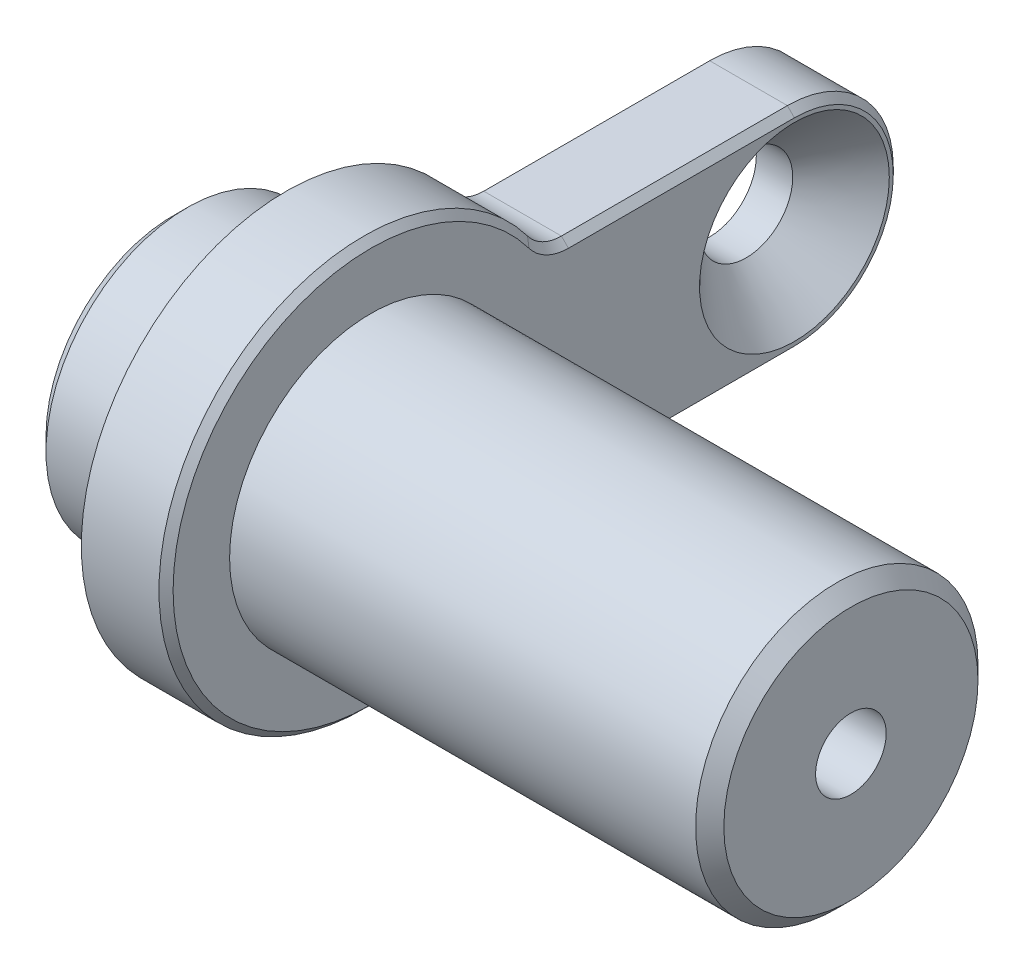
SolidWorks part; units mm, degrees
ref_plane "Front" through (0, 0, 0) normal (0, 0, 1) x (1, 0, 0)
ref_plane "Top" through (0, 0, 0) normal (0, 1, 0) x (1, 0, 0)
ref_plane "Right" through (0, 0, 0) normal (1, 0, 0) x (0, 0, -1)
sketch "Sketch1" plane through (0, 0, 0) normal (1, 0, 0) x (0, -1, 0)
  circle A0 centre (0, 0) radius 10
  dimension "D1" = 20
extrude "Boss-Extrude1" add sketch "Sketch1" along normal blind 40 and the other way blind 8
sketch "Sketch3" plane through (0, 0, 0) normal (1, 0, 0) x (0, 0, -1)
  line L0 (0, 0) -> (30, 0) construction
  line L1 (12.4097, 7.5) -> (30, 7.5)
  line L3 (12.4097, -7.5) -> (30, -7.5)
  line L4 (30, 7.5) -> (30, -7.5) construction
  arc A0 (12.4097, 7.5) -> (12.4097, -7.5) centre (0, 0) ccw
  arc A1 (30, 7.5) -> (30, -7.5) centre (30, 0) cw
  dimension "D1" = 14.5
  dimension "D2" = 30
  dimension "D3" = 15
extrude "Boss-Extrude2" add sketch "Sketch3" along normal blind 6
hole_wizard "CSK for M6 Hex Socket Countersunk Cap Screw1" positions "Sketch5" profile "Sketch4" countersink size "M6" standard "ISO"
sketch "Sketch5" plane through (6, 0, 0) normal (1, 0, 0) x (0, 0, -1)
  point P0 (30, 0)
sketch "Sketch4" plane through (6, 0, -30) normal (0, 1, 0) x (0, 0, -1)
  line L0 (0, 0) -> (0, 14)
  line L1 (0, 14) -> (3.3, 14)
  line L2 (3.3, 14) -> (3.3, 3.42)
  line L3 (3.3, 3.42) -> (6.72, 0)
  line L5 (6.72, 0) -> (0, 0)
  line L6 (-3.3, 3.42) -> (-6.72, 0) construction
  line L11 (0, -6.35) -> (0, 107.95) construction
  dimension "Thru Hole Dia." = 6.6
  dimension "Thru Hole Depth" = 14
  dimension "Near C'Sink Dia." = 13.44
  dimension "Near C'Sink Angle" = 90
fillet "Fillet1" radius 3 2 edges at (3, 7.5, -12.4097) (3, -7.5, -12.4097)
chamfer "Chamfer1" distance 1 angle 45 1 edges at (-8, 0, -10)
chamfer "Chamfer2" distance 0.5 angle 45 6 edges at (6, 0, -37.5) (6, 7.5, -22) (6, -7.5, -22) (6, 7.8167, -12.6584) (6, -7.8167, -12.6584) (6, 0, 14.5)
chamfer "Chamfer3" distance 1 angle 45 1 edges at (40, 0, -10)
hole_wizard "M6 Tapped Hole1" positions "Sketch7" profile "Sketch6" tap size "M6" standard "ISO"
sketch "Sketch7" plane through (40, 0, 0) normal (1, 0, 0) x (0, 0, -1)
  point P0 (0, 0)
sketch "Sketch6" plane through (40, 0, 0) normal (0, 1, 0) x (0, 0, -1)
  line L0 (0, 0) -> (0, 18.5022)
  line L1 (0, 18.5022) -> (2.5, 17)
  line L2 (2.5, 17) -> (2.5, 0)
  line L5 (2.5, 0) -> (0, 0)
  line L10 (0, 18.5022) -> (-2.5, 17) construction
  line L11 (0, -6.35) -> (0, 107.95) construction
  dimension "Tap Drill Dia." = 5
  dimension "Tap Drill Depth" = 17
  dimension "Drill Angle" = 118
hole_wizard "M8 Tapped Hole1" positions "Sketch9" profile "Sketch8" tap size "M8" standard "ISO"
sketch "Sketch9" plane through (-8, 0, 0) normal (-1, 0, 0) x (0, 0, 1)
  point P0 (0, 0)
sketch "Sketch8" plane through (-8, 0, 0) normal (0, 1, 0) x (0, 0, 1)
  line L0 (0, 0) -> (0, 24.2929)
  line L1 (0, 24.2929) -> (3.4, 22.25)
  line L2 (3.4, 22.25) -> (3.4, 0)
  line L5 (3.4, 0) -> (0, 0)
  line L10 (0, 24.2929) -> (-3.4, 22.25) construction
  line L11 (0, -6.35) -> (0, 107.95) construction
  dimension "Tap Drill Dia." = 6.8
  dimension "Tap Drill Depth" = 22.25
  dimension "Drill Angle" = 118
